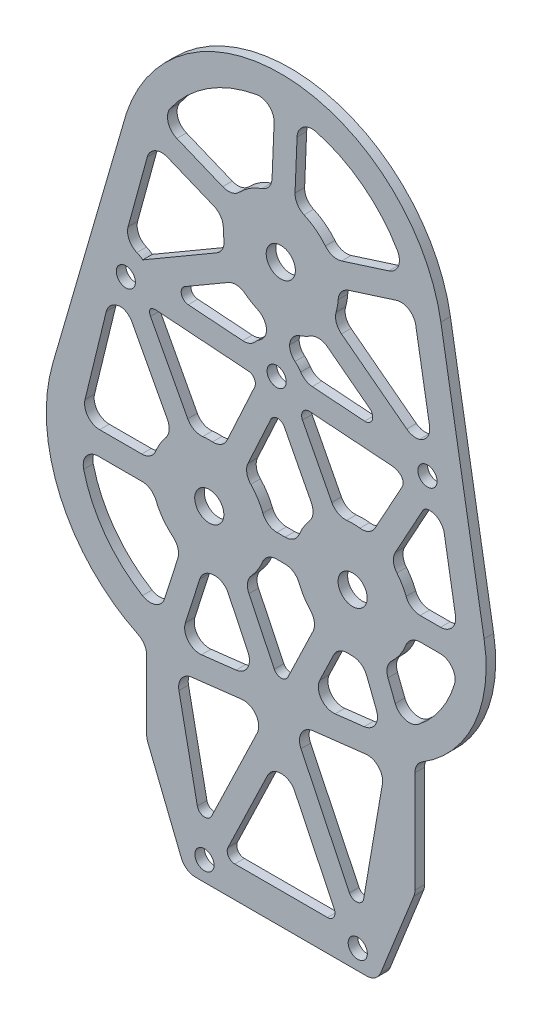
SolidWorks part; units mm, degrees
ref_plane "Front Plane" through (0, 0, 0) normal (0, 0, 1) x (1, 0, 0)
ref_plane "Top Plane" through (0, 0, 0) normal (0, 1, 0) x (1, 0, 0)
ref_plane "Right Plane" through (0, 0, 0) normal (1, 0, 0) x (0, 0, -1)
sketch "Sketch2" plane through (0, 0, 0) normal (0, 0, 1) x (1, 0, 0)
  line L0 (-51.4523, 75.7894) -> (48.4946, 68.6222) construction
  line L1 (16.5234, 114.9719) -> (41.2732, 122.8486)
  line L2 (4.4637, 124.1744) -> (5.527, 150.1256)
  line L3 (18.8343, 107.7108) -> (43.5841, 115.5874)
  line L4 (17.0455, 97.3932) -> (37.6993, 81.6448)
  line L5 (-0.1072, 105.6809) -> (84.2094, 132.5148) construction
  line L6 (-0.1072, 105.6809) -> (5.3603, 239.1239) construction
  line L7 (-3.1499, 124.4864) -> (-2.0866, 150.4375)
  line L8 (-0.1072, 105.6809) -> (-82.9144, 139.7207) construction
  line L9 (-0.1072, 105.6809) -> (68.4071, 53.439) construction
  line L10 (-15.9221, 116.3013) -> (-39.9445, 126.1763)
  line L11 (-0.1072, 105.6809) -> (-86.0859, 55.6268) construction
  line L12 (-18.8192, 109.2536) -> (-42.8417, 119.1286)
  line L13 (-18.1548, 99.5828) -> (-45.8247, 83.4742)
  line L14 (-0.1072, 105.6809) -> (-1.4788, 72.2058) construction
  line L15 (-14.3211, 92.9975) -> (-38.8683, 78.7068)
  line L16 (-4.6782, 87.1874) -> (-4.9282, 81.0843)
  line L17 (2.9354, 86.8755) -> (2.6854, 80.7723)
  line L18 (-38.8683, 78.7068) -> (-9.9137, 76.6305)
  line L19 (7.5011, 75.3816) -> (36.0291, 73.3359)
  line L20 (12.4252, 91.3338) -> (36.0291, 73.3359)
  line L21 (51.6238, 69.1598) -> (44.0462, 113.2665) construction
  line L22 (37.6993, 81.6448) -> (43.8628, 76.9451)
  line L23 (44.0462, 113.2665) -> (50.1033, 78.0104)
  line L24 (39.5147, 65.4463) -> (5.0296, 67.9193)
  line L26 (47.6235, 59.1371) -> (36.0334, 38.0767)
  line L27 (-43.3163, 117.5151) -> (-52.1423, 85.2894)
  line L28 (-54.5145, 76.6281) -> (-43.3163, 117.5151) construction
  line L29 (-7.2441, 68.7995) -> (-43.0173, 71.3648)
  line L30 (-1.4788, 72.2058) -> (23.6962, 23.5612) construction
  line L31 (23.6962, 23.5612) -> (48.4946, 68.6222) construction
  line L32 (-51.4523, 75.7894) -> (-23.8033, 23.7713) construction
  line L33 (-23.8033, 23.7713) -> (-1.4788, 72.2058) construction
  line L34 (23.6962, 23.5612) -> (-23.8033, 23.7713) construction
  line L35 (-7.2441, 68.7995) -> (-19.4503, 42.3173)
  line L36 (-43.9907, 69.8691) -> (-29.1994, 42.041)
  line L37 (-1.2807, 63.5337) -> (-12.53, 39.1276)
  line L38 (-5.1215, 27.4987) -> (5.0482, 27.4537)
  line L39 (11.7336, 38.3868) -> (-1.2807, 63.5337)
  line L40 (40.9477, 62.811) -> (29.3575, 41.7506)
  line L42 (-50.7193, 66.2927) -> (-35.928, 38.4646)
  line L43 (51.668, 68.9573) -> (58.7671, 27.3712) construction
  line L44 (23.6962, 23.5612) -> (99.3125, 23.5612) construction
  line L46 (18.501, 41.8891) -> (5.0296, 67.9193)
  line L48 (-54.5366, 76.5428) -> (-66.4961, 27.5813) construction
  line L49 (-23.8033, 23.7713) -> (-96.1397, 23.7713) construction
  line L51 (-66.4961, 27.5813) -> (-42.4684, 27.5813)
  line L52 (42.3613, 27.3712) -> (58.7671, 27.3712)
  line L53 (-42.4243, 19.7512) -> (-66.4769, 19.7512)
  line L54 (5.0311, 19.7512) -> (-5.1823, 19.7512)
  line L55 (58.7671, 19.7512) -> (42.3613, 19.7512)
  line L56 (-12.2761, 8.6047) -> (-0.0018, -16.9004)
  line L57 (-23.8033, 23.7713) -> (25.4, -78.4691) construction
  line L58 (23.6962, 23.5612) -> (-25.4, -78.4691) construction
  line L59 (12.1698, 8.3941) -> (-0.0018, -16.9004)
  line L60 (44.3608, -15.6786) -> (-44.5435, -26.0967) construction
  line L61 (25.4, -78.4691) -> (-25.4, -78.4691) construction
  line L62 (-0.0013, -34.4732) -> (-19.3385, -74.6591)
  line L63 (-19.3385, -74.6591) -> (19.3382, -74.6591)
  line L64 (19.3382, -74.6591) -> (-0.0013, -34.4732)
  line L67 (-26.28, -71.5111) -> (-3.9859, -25.1801)
  line L68 (-3.9859, -25.1801) -> (-34.9408, -28.8075)
  line L69 (-34.9408, -28.8075) -> (-26.28, -71.5111)
  line L70 (-28.5938, -79.2709) -> (-39.498, -25.5055) construction
  line L71 (-33.0981, 7.1427) -> (-40.39, -15.7518)
  line L72 (-23.8033, 23.7713) -> (-39.498, -25.5055) construction
  line L73 (-25.8375, 4.8302) -> (-34.0753, -21.034)
  line L74 (-19.1424, 5.3003) -> (-7.9427, -17.9717)
  line L75 (23.6962, 23.5612) -> (39.3153, -16.2699) construction
  line L76 (34.0573, 7.5753) -> (40.0465, -7.6981)
  line L77 (26.9632, 4.7935) -> (33.9645, -13.0609)
  line L78 (19.0362, 5.09) -> (8.8881, -15.9994)
  line L79 (-7.9427, -17.9717) -> (-34.0753, -21.034)
  line L80 (33.9645, -13.0609) -> (8.8881, -15.9994)
  line L81 (39.3153, -16.2699) -> (28.5215, -79.0499) construction
  line L82 (34.6968, -20.6472) -> (26.0381, -71.009)
  line L83 (34.6968, -20.6472) -> (3.5575, -24.2962)
  line L84 (3.5575, -24.2962) -> (26.0381, -71.009)
  line L85 (53.1443, 60.3092) -> (58.7671, 27.3712)
  line L86 (-56.6675, 67.8191) -> (-66.4961, 27.5813)
  line L87 (-51.2911, 122.767) -> (-75.6748, 38.8152)
  line L88 (67.2596, 31.252) -> (52.9393, 115.0072)
  line L89 (44.3608, -15.6786) -> (44.3608, -53.2961)
  line L90 (44.3608, -53.2961) -> (31.7098, -84.9746)
  line L91 (31.7098, -84.9746) -> (-31.7902, -84.9746)
  line L92 (-31.7902, -84.9746) -> (-44.5435, -53.2246)
  line L93 (-44.5435, -53.2246) -> (-44.5435, -26.0967)
  circle A0 centre (-1.4788, 72.2058) radius 3.175
  arc A1 (17.0455, 97.3932) -> (12.4252, 91.3338) centre (-0.1072, 105.6809) ccw construction
  arc A2 (44.0462, 113.2665) -> (37.6993, 81.6448) centre (-0.1072, 105.6809) ccw construction
  arc A3 (17.0455, 97.3932) -> (18.8343, 107.7108) centre (-0.1072, 105.6809) ccw
  arc A4 (16.5234, 114.9719) -> (4.4637, 124.1744) centre (-0.1072, 105.6809) ccw
  arc A5 (41.2732, 122.8486) -> (5.527, 150.1256) centre (-0.1072, 105.6809) ccw
  arc A6 (44.0462, 113.2665) -> (43.5841, 115.5874) centre (-0.1072, 105.6809) ccw
  arc A7 (-3.1499, 124.4864) -> (-15.9221, 116.3013) centre (-0.1072, 105.6809) ccw
  arc A8 (-39.9445, 126.1763) -> (-2.0866, 150.4375) centre (-0.1072, 105.6809) cw
  arc A9 (-18.1548, 99.5828) -> (-18.8192, 109.2536) centre (-0.1072, 105.6809) cw
  circle A11 centre (-1.4788, 72.2058) radius 9.525 construction
  arc A12 (-4.9282, 81.0843) -> (-9.9137, 76.6305) centre (-1.4788, 72.2058) ccw
  arc A14 (-4.6782, 87.1874) -> (-14.3211, 92.9975) centre (-0.1072, 105.6809) cw
  arc A17 (2.6854, 80.7723) -> (7.5011, 75.3816) centre (-1.4788, 72.2058) cw
  circle A18 centre (23.6962, 23.5612) radius 19.05 construction
  circle A19 centre (-23.8033, 23.7713) radius 19.05 construction
  circle A20 centre (23.6962, 23.5612) radius 35.2772 construction
  arc A21 (43.8628, 76.9451) -> (50.1033, 78.0104) centre (48.4946, 68.6222) cw
  circle A22 centre (48.4946, 68.6222) radius 9.525 construction
  circle A24 centre (-51.4523, 75.7894) radius 9.525 construction
  arc A25 (-42.8417, 119.1286) -> (-43.3163, 117.5151) centre (-0.1072, 105.6809) ccw
  arc A27 (-45.8247, 83.4742) -> (-52.1423, 85.2894) centre (-51.4523, 75.7894) ccw
  circle A28 centre (-23.8033, 23.7713) radius 42.8625 construction
  arc A29 (-43.0173, 71.3648) -> (-43.9907, 69.8691) centre (-51.4523, 75.7894) cw
  arc A31 (-19.4503, 42.3173) -> (-29.1994, 42.041) centre (-23.8033, 23.7713) ccw
  arc A33 (-12.53, 39.1276) -> (-5.1215, 27.4987) centre (-23.8033, 23.7713) cw
  arc A34 (5.0482, 27.4537) -> (11.7336, 38.3868) centre (23.6962, 23.5612) cw
  arc A35 (40.9477, 62.811) -> (39.5147, 65.4463) centre (48.4946, 68.6222) cw
  arc A37 (18.501, 41.8891) -> (29.3575, 41.7506) centre (23.6962, 23.5612) cw
  arc A39 (36.0334, 38.0767) -> (42.3613, 27.3712) centre (23.6962, 23.5612) cw
  arc A40 (53.1443, 60.3092) -> (47.6235, 59.1371) centre (48.4946, 68.6222) cw
  arc A43 (-50.7193, 66.2927) -> (-56.6675, 67.8191) centre (-51.4523, 75.7894) cw
  arc A45 (-42.4684, 27.5813) -> (-35.928, 38.4646) centre (-23.8033, 23.7713) cw
  arc A47 (-5.1823, 19.7512) -> (-12.2761, 8.6047) centre (-23.8033, 23.7713) cw
  arc A48 (12.1698, 8.3941) -> (5.0311, 19.7512) centre (23.6962, 23.5612) cw
  arc A49 (-33.0981, 7.1427) -> (-42.4243, 19.7512) centre (-23.8033, 23.7713) cw
  arc A50 (-40.39, -15.7518) -> (-66.4769, 19.7512) centre (-23.8033, 23.7713) cw
  arc A52 (-19.1424, 5.3003) -> (-25.8375, 4.8302) centre (-23.8033, 23.7713) cw
  circle A54 centre (-25.4, -78.4691) radius 9.525 construction
  arc A55 (26.9632, 4.7935) -> (19.0362, 5.09) centre (23.6962, 23.5612) cw
  arc A57 (58.7671, 19.7512) -> (40.0465, -7.6981) centre (23.6962, 23.5612) cw
  arc A58 (42.3613, 19.7512) -> (34.0573, 7.5753) centre (23.6962, 23.5612) cw
  arc A59 (67.2596, 31.252) -> (44.3608, -15.6786) centre (23.591, 23.5073) cw
  arc A61 (12.4252, 91.3338) -> (2.9354, 86.8755) centre (-0.1072, 105.6809) cw
  arc A62 (-44.5435, -26.0967) -> (-75.6748, 38.8152) centre (-23.8033, 23.7713) cw
  circle A64 centre (-25.4, -78.4691) radius 3.175
  circle A65 centre (25.4, -78.4691) radius 3.175
  circle A66 centre (23.6962, 23.5612) radius 4.826
  circle A67 centre (-23.8033, 23.7713) radius 4.826
  circle A68 centre (48.4946, 68.6222) radius 3.175
  circle A69 centre (-51.4523, 75.7894) radius 3.175
  circle A70 centre (-0.1072, 105.6809) radius 4.826
  arc A71 (-51.2911, 122.767) -> (52.9393, 115.0072) centre (-0.1404, 105.9317) cw
  dimension "D1" = 6.35
  dimension "D2" = 70
  dimension "D6" = 38.1
  dimension "D11" = 3.81
  dimension "D12" = 19.05
  dimension "D16" = 19.05
  dimension "D21" = 19.05
  dimension "D23" = 85.725
  dimension "D47" = 19.05
  dimension "D53" = 3.81
  dimension "D54" = 3.81
  dimension "D58" = 85.5
  dimension "D4" = 7.62
  dimension "D5" = 3.81
  dimension "D7" = 3.81
  dimension "D8" = 3.81
  dimension "D9" = 70
  dimension "D10" = 3.81
  dimension "D13" = 3.81
  dimension "D14" = 3.81
  dimension "D15" = 3.81
  dimension "D17" = 3.81
  dimension "D18" = 3.81
  dimension "D19" = 3.81
  dimension "D20" = 3.81
  dimension "D22" = 3.81
  dimension "D24" = 3.81
  dimension "D25" = 3.81
  dimension "D27" = 3.81
  dimension "D28" = 3.81
  dimension "D30" = 3.81
  dimension "D31" = 3.81
  dimension "D32" = 3.81
  dimension "D33" = 3.81
  dimension "D34" = 3.81
  dimension "D35" = 3.81
  dimension "D36" = 3.81
  dimension "D37" = 3.81
  dimension "D38" = 3.81
  dimension "D39" = 3.81
  dimension "D40" = 3.81
  dimension "D41" = 3.81
  dimension "D42" = 3.81
  dimension "D43" = 5.08
  dimension "D44" = 3.81
  dimension "D45" = 3.81
  dimension "D46" = 3.81
  dimension "D48" = 3.81
  dimension "D49" = 5.08
  dimension "D50" = 3.81
  dimension "D51" = 3.81
  dimension "D52" = 3.81
  dimension "D55" = 3.81
  dimension "D56" = 3.81
  dimension "D57" = 3.81
  dimension "D59" = 47.5
extrude "Boss-Extrude1" add sketch "Sketch2" along normal blind 3.175
fillet "Fillet1" radius 5 68 edges at (-34.9408, -28.8075, 1.5875) (-3.9859, -25.1801, 1.5875) (-0.0013, -34.4732, 1.5875) (3.5575, -24.2962, 1.5875) (19.0362, 5.09, 1.5875) (33.9645, -13.0609, 1.5875) (34.6968, -20.6472, 1.5875) (-7.9427, -17.9717, 1.5875) (-34.0753, -21.034, 1.5875) (-40.39, -15.7518, 1.5875) (-33.0981, 7.1427, 1.5875) (-42.4243, 19.7512, 1.5875) (-66.4769, 19.7512, 1.5875) (-19.1424, 5.3003, 1.5875) (-25.8375, 4.8302, 1.5875) (7.5011, 75.3816, 1.5875) (12.4252, 91.3338, 1.5875) (2.9354, 86.8755, 1.5875) (2.6854, 80.7723, 1.5875) (-9.9137, 76.6305, 1.5875) (-4.9282, 81.0843, 1.5875) (-4.6782, 87.1874, 1.5875) (-14.3211, 92.9975, 1.5875) (-42.8417, 119.1286, 1.5875) (-52.1423, 85.2894, 1.5875) (-18.1548, 99.5828, 1.5875) (-18.8192, 109.2536, 1.5875) (-15.9221, 116.3013, 1.5875) (-39.9445, 126.1763, 1.5875) (-2.0866, 150.4375, 1.5875) (-3.1499, 124.4864, 1.5875) (16.5234, 114.9719, 1.5875) (4.4637, 124.1744, 1.5875) (5.527, 150.1256, 1.5875) (41.2732, 122.8486, 1.5875) (43.5841, 115.5874, 1.5875) (17.0455, 97.3932, 1.5875) (18.8343, 107.7108, 1.5875) (50.1033, 78.0104, 1.5875) (43.8628, 76.9451, 1.5875) (58.7671, 27.3712, 1.5875) (36.0334, 38.0767, 1.5875) (42.3613, 27.3712, 1.5875) (42.3613, 19.7512, 1.5875) (34.0573, 7.5753, 1.5875) (8.8881, -15.9994, 1.5875) (40.0465, -7.6981, 1.5875) (12.1698, 8.3941, 1.5875) (39.5147, 65.4463, 1.5875) (53.1443, 60.3092, 1.5875) (58.7671, 19.7512, 1.5875) (26.9632, 4.7935, 1.5875) (5.0311, 19.7512, 1.5875) (-5.1823, 19.7512, 1.5875) (29.3575, 41.7506, 1.5875) (11.7336, 38.3868, 1.5875) (5.0482, 27.4537, 1.5875) (-5.1215, 27.4987, 1.5875) (-12.53, 39.1276, 1.5875) (-19.4503, 42.3173, 1.5875) (-29.1994, 42.041, 1.5875) (-66.4961, 27.5813, 1.5875) (-42.4684, 27.5813, 1.5875) (-35.928, 38.4646, 1.5875) (-50.7193, 66.2927, 1.5875) (-56.6675, 67.8191, 1.5875) (-12.2761, 8.6047, 1.5875) (18.501, 41.8891, 1.5875)
fillet "Fillet2" radius 2.5 14 edges at (-43.9907, 69.8691, 1.5875) (-43.0173, 71.3648, 1.5875) (47.6235, 59.1371, 1.5875) (40.9477, 62.811, 1.5875) (36.0291, 73.3359, 1.5875) (-38.8683, 78.7068, 1.5875) (-26.28, -71.5111, 1.5875) (19.3382, -74.6591, 1.5875) (-19.3385, -74.6591, 1.5875) (26.0381, -71.009, 1.5875) (-0.0018, -16.9004, 1.5875) (5.0296, 67.9193, 1.5875) (-1.2807, 63.5337, 1.5875) (-7.2441, 68.7995, 1.5875)
fillet "Fillet3" radius 5.08 6 edges at (-44.5435, -53.2246, 1.5875) (-44.5435, -26.0967, 1.5875) (-31.7902, -84.9746, 1.5875) (31.7098, -84.9746, 1.5875) (44.3608, -15.6786, 1.5875) (44.3608, -53.2961, 1.5875)
